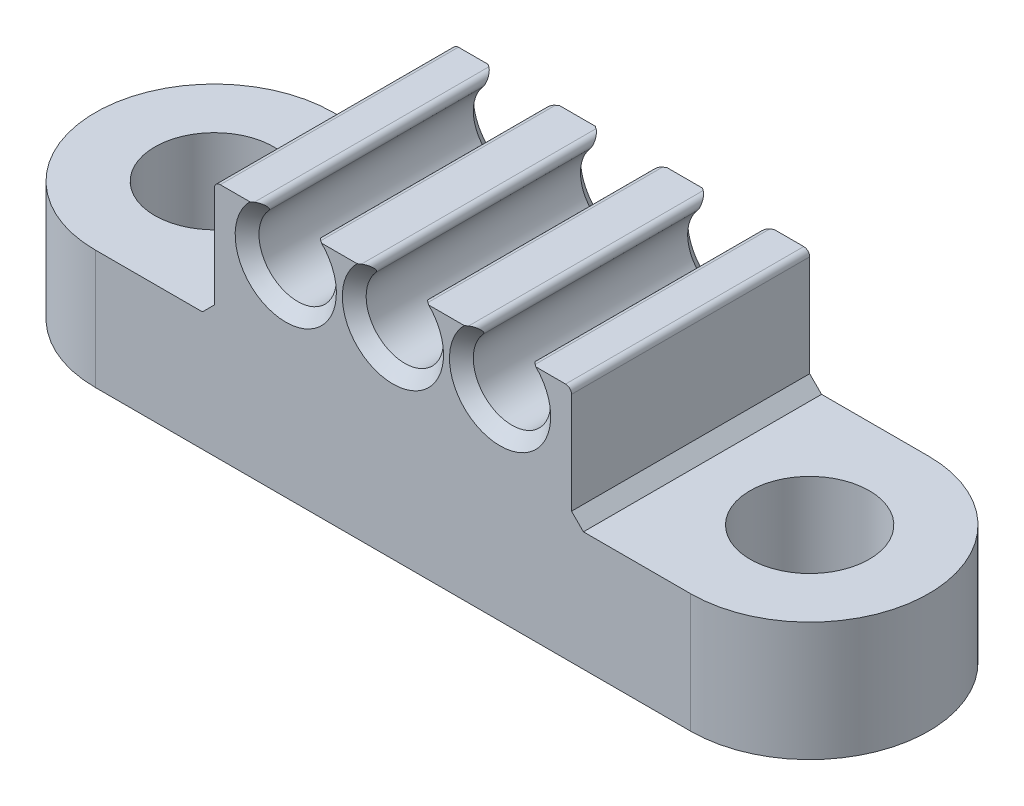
SolidWorks part; units mm, degrees
ref_plane "Ebene vorne" through (0, 0, 0) normal (0, 0, 1) x (1, 0, 0)
ref_plane "Ebene oben" through (0, 0, 0) normal (0, 1, 0) x (1, 0, 0)
ref_plane "Ebene rechts" through (0, 0, 0) normal (1, 0, 0) x (0, 0, -1)
sketch "Skizze1" plane through (0, 0, 0) normal (0, 1, 0) x (1, 0, 0)
  line L0 (0, 0) -> (0, -12.3103) construction
  line L1 (0, 0) -> (-25, 0) construction
  line L2 (-25, -10) -> (25, -10)
  line L3 (-25, 10) -> (25, 10)
  circle A0 centre (-25, 0) radius 5
  arc A1 (-25, 10) -> (-25, -10) centre (-25, 0) ccw
  circle A2 centre (-25, 0) radius 10 construction
  circle A3 centre (25, 0) radius 5
  arc A4 (25, 10) -> (25, -10) centre (25, 0) cw
  point P12 (0, 10)
  point P15 (0, -10)
  dimension "D1" = 10
  dimension "D2" = 50
  dimension "D3" = 5
extrude "Aufsatz-Linear austragen1" add sketch "Skizze1" along normal blind 10
sketch "Skizze2" plane through (0, 10, 0) normal (0, 1, 0) x (1, 0, 0)
  line L0 (25, 10) -> (-25, 10) construction
  line L1 (-15, -10) -> (15, -10)
  line L2 (-15, -10) -> (-15, 10)
  line L3 (-15, 10) -> (15, 10)
  line L4 (15, -10) -> (15, 10)
  line L5 (-15, -10) -> (15, 10) construction
  line L6 (-15, 10) -> (15, -10) construction
  circle A0 centre (-25, 0) radius 5 construction
  point P0 (0, 0)
  dimension "D1" = 10
extrude "Aufsatz-Linear austragen2" add sketch "Skizze2" along normal blind 10
sketch "Skizze3" plane through (0, 0, 10) normal (0, 0, 1) x (1, 0, 0)
  line L0 (-15, 17) -> (15, 17) construction
  line L1 (-15, 20) -> (-15, 10) construction
  line L2 (15, 20) -> (15, 10) construction
  line L3 (-15, 20) -> (15, 20) construction
  line L4 (0, 17) -> (0, 0) construction
  circle A0 centre (0, 17) radius 3.25
  circle A1 centre (9, 17) radius 3.25
  circle A2 centre (-9, 17) radius 3.25
  dimension "D2" = 6.5
  dimension "D1" = 3
  dimension "D4" = 9
  dimension "D3" = 2
extrude "Schnitt-Linear austragen1" cut sketch "Skizze3" against normal through all and the other way through all contours A2 | A0 | A1
chamfer "Fase3" distance 1 angle 45 6 edges at (9, 13.75, -10) (9, 13.75, 10) (0, 13.75, -10) (0, 13.75, 10) (-9, 13.75, -10) (-9, 13.75, 10)
fillet "Verrundung1" radius 0.5 8 edges at (15, 20, 0) (-15, 20, 0) (10.25, 20, 0) (7.75, 20, 0) (1.25, 20, 0) (-1.25, 20, 0) (-7.75, 20, 0) (-10.25, 20, 0)
chamfer "Fase1" distance 1 angle 45 2 edges at (-15, 10, 0) (15, 10, 0)
